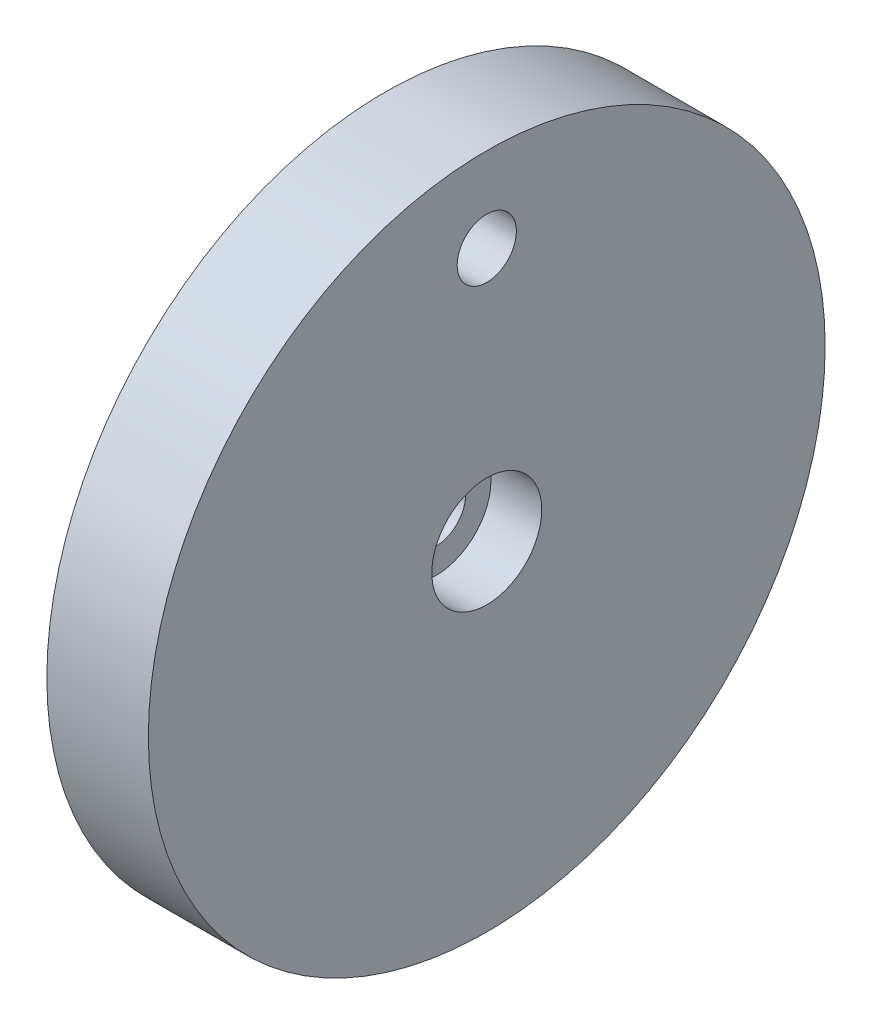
SolidWorks part; units mm, degrees
ref_plane "Front Plane" through (0, 0, 0) normal (0, 0, 1) x (1, 0, 0)
ref_plane "Top Plane" through (0, 0, 0) normal (0, 1, 0) x (1, 0, 0)
ref_plane "Right Plane" through (0, 0, 0) normal (1, 0, 0) x (0, 0, -1)
sketch "Sketch1" plane through (0, 0, 0) normal (1, 0, 0) x (0, 0, -1)
  line L0 (0, 0) -> (0, 20) construction
  circle A0 centre (0, 0) radius 20
  circle A1 centre (0, 0) radius 1.75
  circle A2 centre (0, 15) radius 1.75
  dimension "D1" = 40
  dimension "D2" = 3.5
  dimension "D3" = 3.5
  dimension "D4" = 15
extrude "Extrude1" add sketch "Sketch1" along normal blind 6
sketch "Sketch2" plane through (0, 0, 0) normal (-1, 0, 0) x (0, 0, 1)
  circle A0 centre (0, 15) radius 3.25
  dimension "D1" = 6.5
extrude "Extrude2" cut sketch "Sketch2" against normal blind 3
sketch "Sketch3" plane through (6, 0, 0) normal (1, 0, 0) x (0, 0, -1)
  circle A0 centre (0, 0) radius 3.25
  dimension "D1" = 6.5
extrude "Extrude3" cut sketch "Sketch3" against normal blind 3
